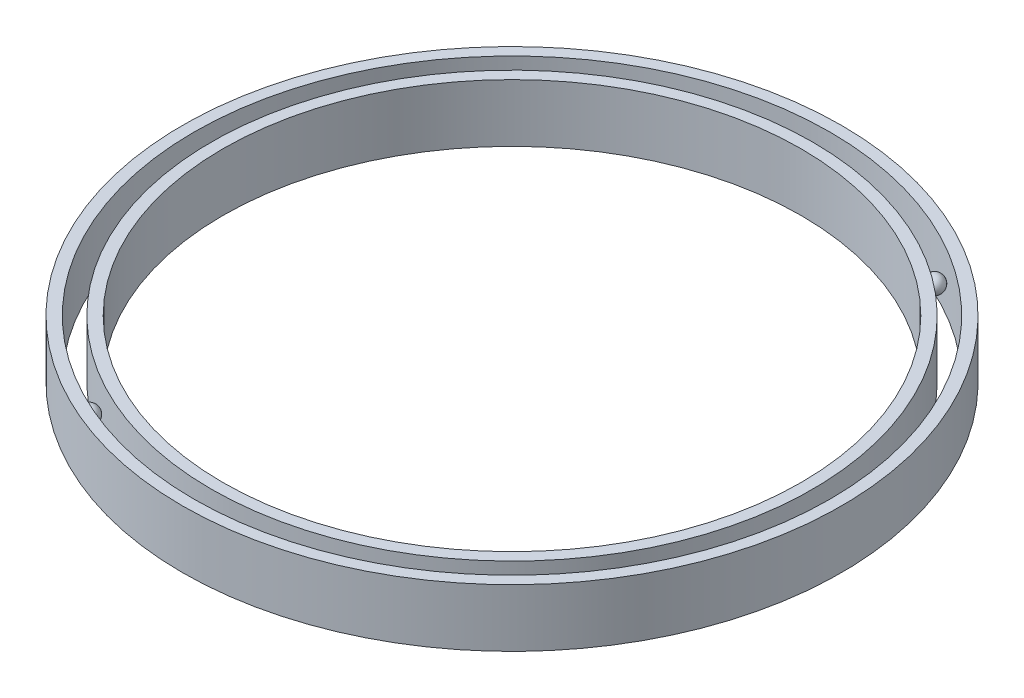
SolidWorks part; units mm, degrees
ref_plane "Front Plane" through (0, 0, 0) normal (0, 0, 1) x (1, 0, 0)
ref_plane "Top Plane" through (0, 0, 0) normal (0, 1, 0) x (1, 0, 0)
ref_plane "Right Plane" through (0, 0, 0) normal (1, 0, 0) x (0, 0, -1)
sketch "Sketch1" plane through (0, 0, 0) normal (0, 0, 1) x (1, 0, 0)
  line L0 (0, 0) -> (0, 98.0663) construction
  line L1 (100, 10) -> (100, -10)
  line L2 (100, 10) -> (104, 10)
  line L3 (100, -10) -> (104, -10)
  line L4 (104, 10) -> (104, -10)
  dimension "D1" = 100
  dimension "D2" = 4
  dimension "D3" = 20
  dimension "D4" = 10
revolve "Revolve1" add sketch "Sketch1" angle 360 about L0
sketch "Sketch2" plane through (0, 0, 0) normal (0, 0, 1) x (1, 0, 0)
  line L0 (110, 10) -> (110, -10)
  line L1 (110, 10) -> (114, 10)
  line L2 (110, -10) -> (114, -10)
  line L3 (114, 10) -> (114, -10)
  line L4 (0, 0) -> (0, 62.8699) construction
  point P4 (0, 0)
  dimension "D1" = 110
  dimension "D2" = 4
  dimension "D3" = 10
  dimension "D4" = 20
revolve "Revolve2" add sketch "Sketch2" angle 360 about L4
sketch "Sketch3" plane through (0, 0, 0) normal (0, 1, 0) x (1, 0, 0)
  line L0 (104, 0) -> (110, 0)
  line L1 (0, 0) -> (110, 0) construction
  circle A0 centre (0, 0) radius 104 construction
  circle A1 centre (0, 0) radius 110 construction
  arc A2 (110, 0) -> (104, 0) centre (107, 0) ccw
revolve "Revolve3" add sketch "Sketch3" angle 360 about L0
pattern_circular "CirPattern1" count 6 over 360 about axis through (0, 0, 0) along (0, 1, 0)
